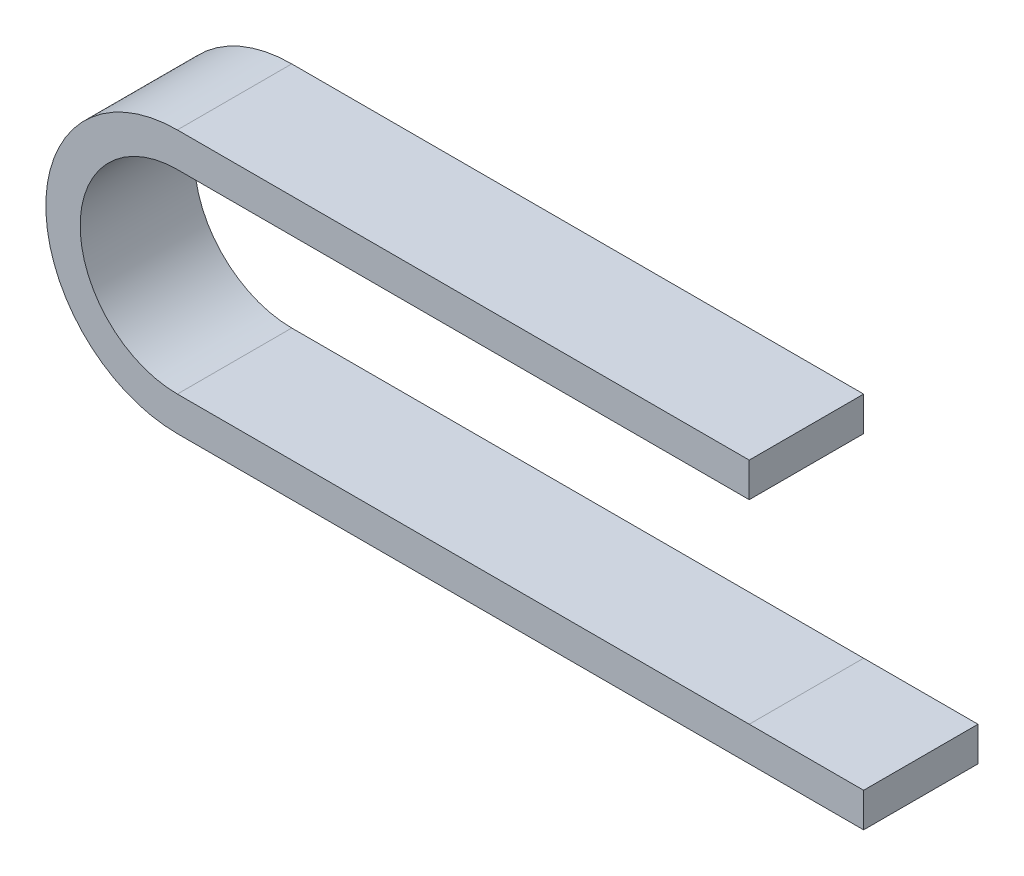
SolidWorks part; units mm, degrees
ref_plane "Front" through (0, 0, 0) normal (0, 0, 1) x (1, 0, 0)
ref_plane "Top" through (0, 0, 0) normal (0, 1, 0) x (1, 0, 0)
ref_plane "Right" through (0, 0, 0) normal (1, 0, 0) x (0, 0, -1)
sketch "Sketch1" plane through (0, 0, 0) normal (0, 0, 1) x (1, 0, 0)
  line L0 (0, 0) -> (30, 0)
  line L1 (0, -33.6031) -> (0, 41.6134) construction
  line L3 (30, -44.9382) -> (30, 41.6134) construction
  line L4 (0, 10) -> (25, 10)
  line L5 (25, 41.6134) -> (25, -44.9382) construction
  arc A0 (0, 10) -> (0, 0) centre (0, 5) ccw
  dimension "D1" = 10
  dimension "D2" = 5
  dimension "D3" = 30
ref_plane "Plane1" through (30, 0, 0) normal (1, 0, 0) x (0, 0, -1)
sketch "Sketch2" plane through (30, 0, 0) normal (1, 0, 0) x (0, 0, -1)
  line L0 (-106.2603, 0) -> (108.8076, 0) construction
  line L1 (0, -44.9382) -> (0, 114.9253) construction
  line L2 (0, -44.9382) -> (0, 41.6134) construction
  line L4 (-2.5, 0.75) -> (2.5, 0.75)
  line L5 (-2.5, 0.75) -> (-2.5, -0.75)
  line L6 (-2.5, -0.75) -> (2.5, -0.75)
  line L7 (2.5, 0.75) -> (2.5, -0.75)
  dimension "D1" = 5
  dimension "D2" = 2.5
  dimension "D3" = 1.5
  dimension "D4" = 0.75
sweep "Base-Sweep" add profiles "Sketch2" path "Sketch1"
sketch "Sketch3" plane through (0, -0.75, 0) normal (0, -1, 0) x (1, 0, 0)
  line L0 (25, 2.5) -> (25, -2.5)
  line L1 (30, 2.5) -> (30, -2.5) construction
  line L2 (0, 2.5) -> (30, 2.5) construction
  line L3 (0, -2.5) -> (30, -2.5) construction
  dimension "D1" = 5
